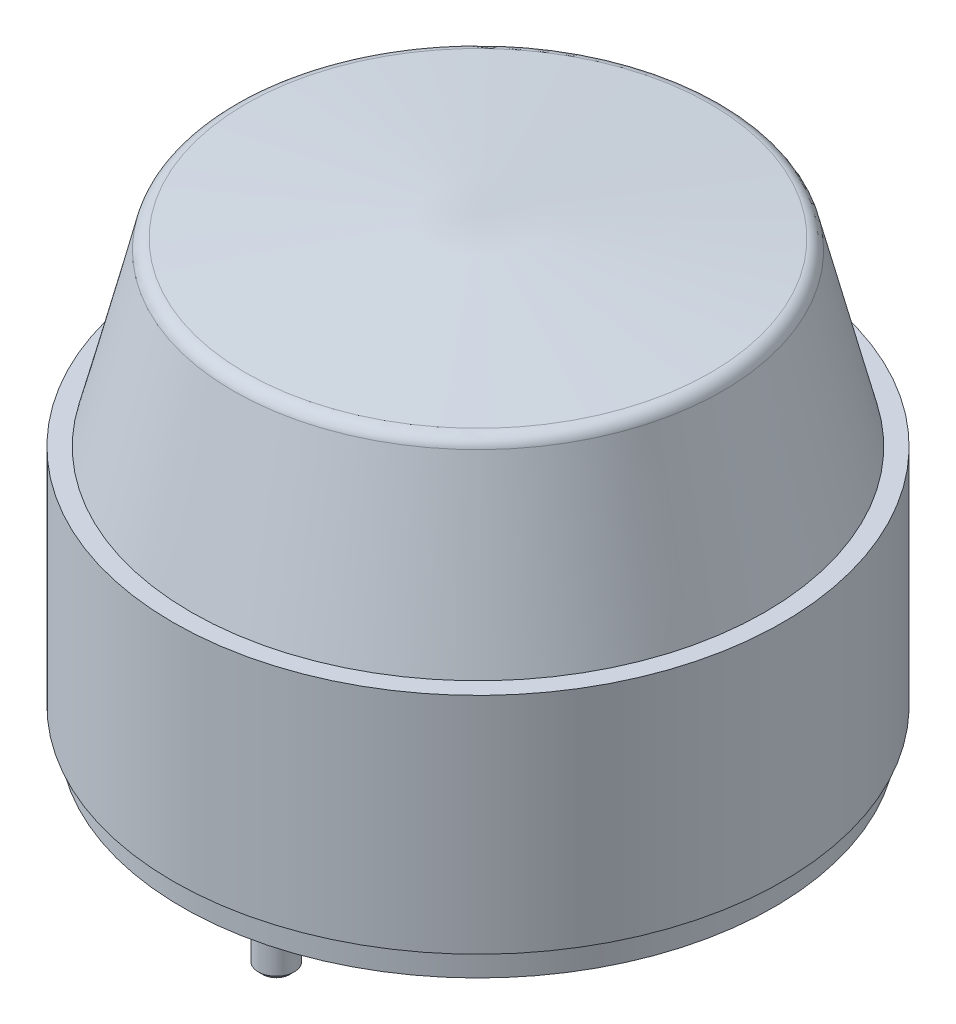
SolidWorks part; units mm, degrees
ref_plane "Plan de face" through (0, 0, 0) normal (0, 0, 1) x (1, 0, 0)
ref_plane "Plan de dessus" through (0, 0, 0) normal (0, 1, 0) x (1, 0, 0)
ref_plane "Plan de droite" through (0, 0, 0) normal (1, 0, 0) x (0, 0, -1)
sketch "Esquisse1" plane through (0, 0, 0) normal (0, 0, 1) x (1, 0, 0)
  line L0 (0, 0) -> (0, 63.3362) construction
  line L1 (0, 0) -> (33, 0)
  line L2 (34, 3) -> (34, 28)
  line L3 (34, 28) -> (32, 28)
  line L4 (32, 28) -> (27, 48)
  line L6 (0, 50.5) -> (0, 0)
  line L7 (34, 3) -> (33, 3)
  line L8 (33, 3) -> (33, 0)
  line L9 (27, 48) -> (0, 50.5)
  dimension "D1" = 68
  dimension "D2" = 66
  dimension "D3" = 64
  dimension "D4" = 54
  dimension "D5" = 3
  dimension "D6" = 25
  dimension "D7" = 20
  dimension "D8" = 50.5
revolve "Révolution1" add sketch "Esquisse1" angle 360 about L0
fillet "Congé1" radius 1.5 1 edges at (0, 48, -27)
sketch "Esquisse2" plane through (0, 0, 0) normal (0, -1, 0) x (1, 0, 0)
  circle A0 centre (0, 22.5) radius 2
  circle A1 centre (0, -22.5) radius 2
  dimension "D3" = 4
  dimension "D1" = 45
  dimension "D2" = 22.5
extrude "Extrusion1" add sketch "Esquisse2" along normal blind 11
sketch "Esquisse3" plane through (0, 0, 0) normal (0, -1, 0) x (1, 0, 0)
  circle A0 centre (0, 0) radius 10
  dimension "D1" = 20
extrude "Enlèv. mat.-Extru.1" cut sketch "Esquisse3" against normal blind 3
chamfer "Chanfrein1" distance 0.5 angle 45 2 edges at (0, -11, -24.5) (0, -11, 20.5)
